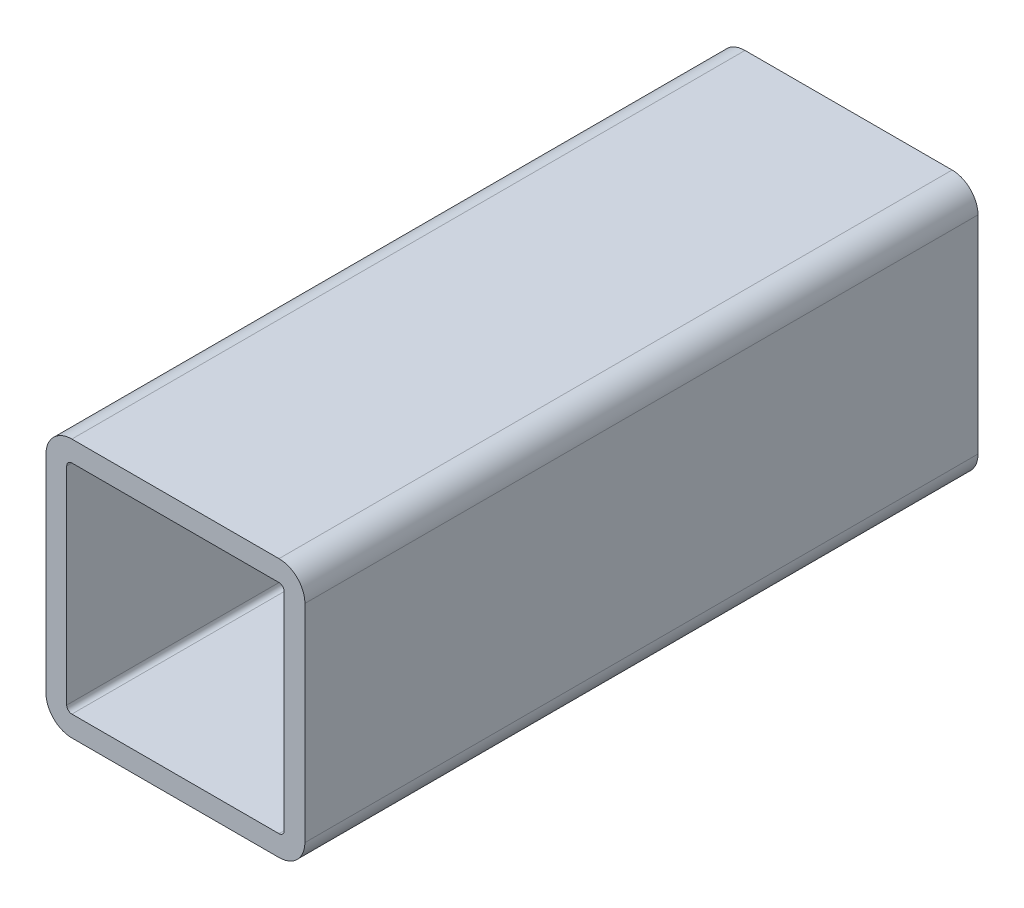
SolidWorks part; units mm, degrees
ref_plane "Face" through (0, 0, 0) normal (0, 0, 1) x (1, 0, 0)
ref_plane "Dessus" through (0, 0, 0) normal (0, 1, 0) x (1, 0, 0)
ref_plane "Droite" through (0, 0, 0) normal (1, 0, 0) x (0, 0, -1)
sketch "Esquisse1" plane through (0, 0, 0) normal (0, 0, 1) x (1, 0, 0)
  line L0 (4, -5) -> (4, -45)
  line L1 (5, 0) -> (45, 0)
  line L2 (0, -5) -> (0, -45)
  line L3 (5, -50) -> (45, -50)
  line L4 (50, -5) -> (50, -45)
  line L5 (5, -46) -> (45, -46)
  line L6 (46, -5) -> (46, -45)
  line L7 (5, -4) -> (45, -4)
  arc A0 (50, -5) -> (45, 0) centre (45, -5) ccw
  arc A1 (50, -45) -> (45, -50) centre (45, -45) cw
  arc A2 (5, -50) -> (0, -45) centre (5, -45) cw
  arc A3 (0, -5) -> (5, 0) centre (5, -5) cw
  arc A4 (5, -46) -> (4, -45) centre (5, -45) cw
  arc A5 (46, -45) -> (45, -46) centre (45, -45) cw
  arc A6 (46, -5) -> (45, -4) centre (45, -5) ccw
  arc A7 (4, -5) -> (5, -4) centre (5, -5) cw
  point P7 (50, 0)
  point P12 (0, -50)
  point P15 (0, 0)
  dimension "D3" = 5
  dimension "D1" = 50
  dimension "D2" = 50
  dimension "D4" = 4
extrude "Base-Extrusion" add sketch "Esquisse1" along normal blind 130
